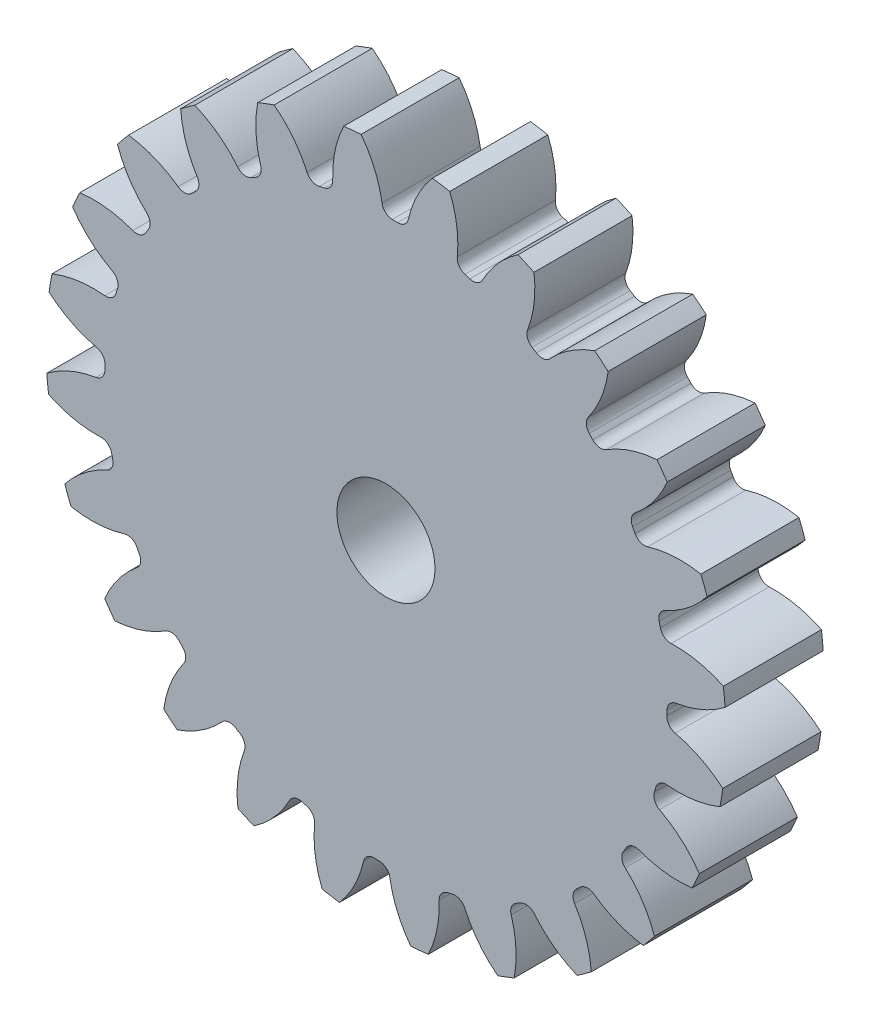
SolidWorks part; units mm, degrees
ref_plane "Front" through (0, 0, 0) normal (0, 0, 1) x (1, 0, 0)
ref_plane "Top" through (0, 0, 0) normal (0, 1, 0) x (1, 0, 0)
ref_plane "Right" through (0, 0, 0) normal (1, 0, 0) x (0, 0, -1)
sketch "Sketch3" plane through (0, 0, 0) normal (0, 0, 1) x (1, 0, 0)
  circle A0 centre (0, 0) radius 440.2667
  dimension "od" = 880.5333
extrude "gearBody" add sketch "Sketch3" along normal blind 127
sketch "Sketch2" plane through (0, 0, 0) normal (0, 0, 1) x (1, 0, 0)
  line L0 (0, 0) -> (352.8214, 146.1434) construction
  line L1 (437.2573, -61.1149) -> (0, 0) construction
  line L2 (0, 0) -> (36.3143, 0) construction
  line L3 (406.1744, 13.5397) -> (404.4818, -39.4394) construction
  line L5 (405.3281, -12.9498) -> (0, 0) construction
  line L7 (0, 0) -> (381.8911, 0) construction
  arc A0 (381.841, 6.1858) -> (380.6674, -30.5472) centre (0, 0) ccw construction
  arc A1 (439.0892, 32.1779) -> (436.1397, -60.1406) centre (0, 0) ccw construction
  arc A2 (406.1744, 13.5397) -> (404.4818, -39.4394) centre (0, 0) ccw construction
  arc A3 (363.7582, -14.9842) -> (363.9728, -8.2661) centre (0, 0) ccw
  arc A4 (437.2573, -61.1149) -> (374.4733, -28.992) centre (342.7731, -168.367) ccw
  arc A5 (437.2573, -61.1149) -> (440.2667, 33.0788) centre (0, 0) ccw
  arc A6 (440.2667, 33.0788) -> (375.5602, 5.0292) centre (352.8214, 146.1434) cw
  arc A7 (363.9728, -8.2661) -> (375.5602, 5.0292) centre (377.753, -8.579) cw
  arc A8 (374.4733, -28.992) -> (363.7582, -14.9842) centre (377.5302, -15.5515) cw
  point P6 (440.2667, 33.0788)
  point P22 (437.2573, -61.1149)
  dimension "baseDia" = 763.7822
  dimension "od" = 880.5333
  dimension "pd" = 812.8
  dimension "rd" = 728.1333
  dimension "rFillet" = 13.7837
  dimension "pointX" = 440.2667
  dimension "pointY" = 33.0788
  dimension "CTT" = 52.9791
  dimension "flankCenterAngle" = 22.5
extrude "toothCut" cut sketch "Sketch2" along normal through all
pattern_circular "CirPattern1" count 24 over 360 about axis through (0, 0, 0) along (0, 0, 1) of "toothCut"
sketch "hub1Dia" plane through (0, 0, 0) normal (0, 0, -1) x (-1, 0, 0)
  circle A0 centre (0, 0) radius 12.7
  dimension "hub1Dia" = 25.4
sketch "hub2Dia" plane through (0, 0, 127) normal (0, 0, 1) x (1, 0, 0)
  circle A0 centre (0, 0) radius 12.7
  dimension "hub2dia" = 25.4
sketch "boreDia" plane through (0, 0, 0) normal (0, 0, 1) x (1, 0, 0)
  circle A0 centre (0, 0) radius 63.5
  dimension "boreDia" = 127
extrude "bore" cut sketch "boreDia" against normal mid plane 25400
